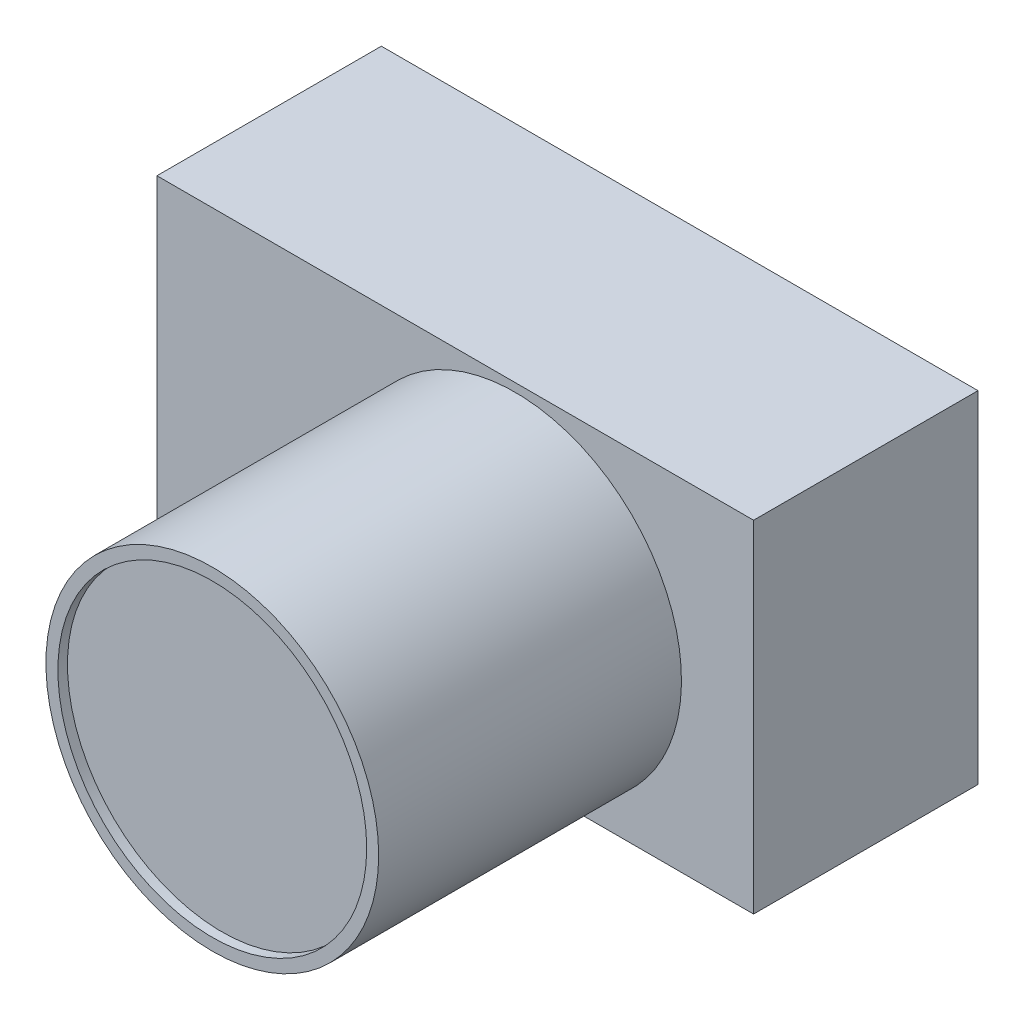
SolidWorks part; units mm, degrees
ref_plane "Front Plane" through (0, 0, 0) normal (0, 0, 1) x (1, 0, 0)
ref_plane "Top Plane" through (0, 0, 0) normal (0, 1, 0) x (1, 0, 0)
ref_plane "Right Plane" through (0, 0, 0) normal (1, 0, 0) x (0, 0, -1)
sketch "Sketch1" plane through (0, 0, 0) normal (0, 0, 1) x (1, 0, 0)
  line L1 (-63.3095, -36.195) -> (63.3095, -36.195)
  line L2 (-63.3095, -36.195) -> (-63.3095, 36.195)
  line L3 (-63.3095, 36.195) -> (63.3095, 36.195)
  line L4 (63.3095, -36.195) -> (63.3095, 36.195)
  line L5 (-63.3095, -36.195) -> (63.3095, 36.195) construction
  line L6 (-63.3095, 36.195) -> (63.3095, -36.195) construction
  point P0 (0, 0)
  dimension "D1" = 72.39
  dimension "D2" = 126.619
extrude "Boss-Extrude1" add sketch "Sketch1" along normal mid plane 47.625
sketch "Sketch2" plane through (0, -36.195, 0) normal (0, -1, 0) x (1, 0, 0)
  circle A0 centre (12.7, 0) radius 3.175
  dimension "D2" = 6.35
  dimension "D1" = 12.7
extrude "Cut-Extrude1" cut sketch "Sketch2" against normal blind 6.35
sketch "Sketch3" plane through (0, 0, 23.8125) normal (0, 0, 1) x (1, 0, 0)
  line L0 (-63.3095, -36.195) -> (63.3095, -36.195) construction
  line L1 (9.525, -36.195) -> (15.875, -36.195) construction
  line L2 (9.525, -36.195) -> (15.875, -36.195) construction
  line L3 (12.7, -0.889) -> (12.7, -36.195) construction
  circle A0 centre (12.7, -0.889) radius 35.306
  dimension "D1" = 70.612
extrude "Boss-Extrude2" add sketch "Sketch3" along normal blind 64.262
sketch "Sketch4" plane through (0, 0, 88.0745) normal (0, 0, 1) x (1, 0, 0)
  circle A2 centre (12.7, -0.889) radius 32.766
  circle A3 centre (12.7, -0.889) radius 32.766
  dimension "D1" = 2.54
extrude "Cut-Extrude2" cut sketch "Sketch4" against normal blind 2.032
